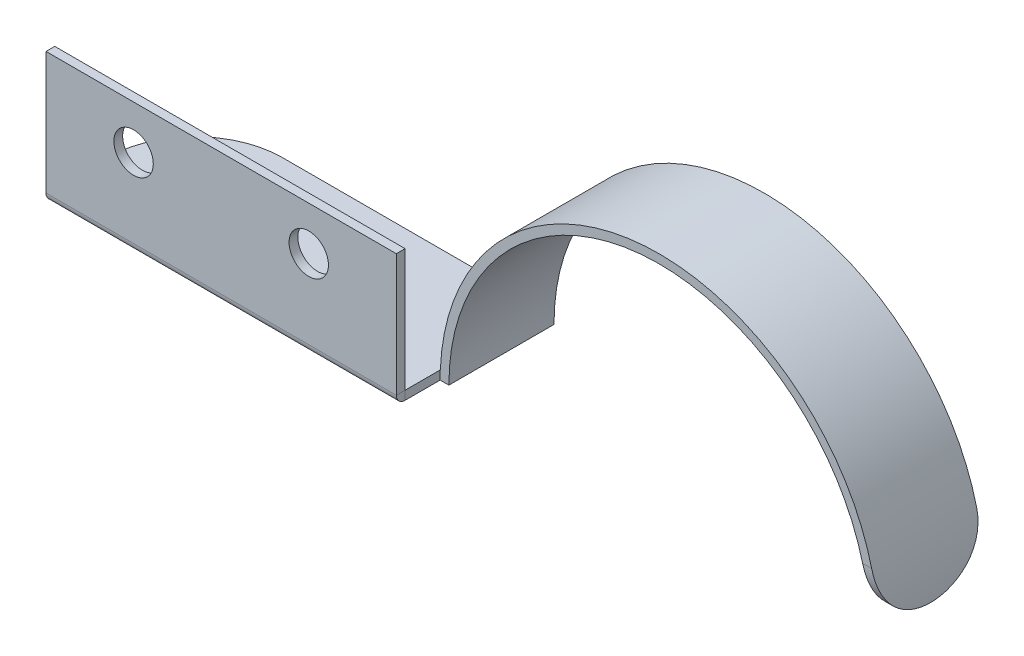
SolidWorks part; units mm, degrees
ref_plane "Front Plane" through (0, 0, 0) normal (0, 0, 1) x (1, 0, 0)
ref_plane "Top Plane" through (0, 0, 0) normal (0, 1, 0) x (1, 0, 0)
ref_plane "Right Plane" through (0, 0, 0) normal (1, 0, 0) x (0, 0, -1)
sketch "Sketch1" plane through (0, 0, 0) normal (0, 1, 0) x (1, 0, 0)
  line L1 (0, 0) -> (40, 0)
  line L2 (0, 0) -> (0, 20)
  line L3 (10, 30) -> (40, 30)
  line L4 (40, 0) -> (40, 30)
  arc A0 (0, 20) -> (10, 30) centre (10, 20) cw
  circle A1 centre (10, 5) radius 2.25
  circle A2 centre (30, 5) radius 2.25
  point P7 (0, 30)
  dimension "D3" = 10
  dimension "D4" = 4.5
  dimension "D5" = 4.5
  dimension "D6" = 5
  dimension "D7" = 5
  dimension "D8" = 10
  dimension "D9" = 10
  dimension "D1" = 40
  dimension "D2" = 30
sheet metal parameters "Sheet-Metal1" thickness 1 parameters "D1"=0.0001
base flange "Base-Flange1" sketch "Sketch1" thickness 1 reverse thickness direction yes parameters "D1"=0.0001
sketch "Sketch3" plane through (0, 1, 0) normal (0, 1, 0) x (1, 0, 0)
  line L0 (0, 14) -> (40, 14)
  line L1 (0, 20) -> (0, 0) construction
  line L2 (40, 0) -> (40, 30) construction
  line L3 (0, 0) -> (40, 0) construction
  dimension "D1" = 14
sketched bend "Sketched Bend1" parameters "D1"=0.001
bend "SketchBend1" bend radius 0.0001 bend angle 90 parameters "D5"=1
sketch "Sketch4" plane through (0, 0, -30) normal (0, 0, -1) x (-1, 0, 0)
  line L0 (-40, 0) -> (-41, 0)
  line L1 (-41, 0) -> (-89, 0) construction
  line L2 (-89, 0) -> (-90, 0)
  line L3 (-40, 1) -> (-40.02, 1)
  line L4 (-40, 1) -> (-40, -0.016)
  arc A0 (-41, 0) -> (-89, 0) centre (-65, 0) ccw
  arc A1 (-40.02, 1) -> (-90, 0) centre (-65, 0) ccw
  dimension "D1" = 1
  dimension "D2" = 24
extrude "Extrude1" add sketch "Sketch4" against normal blind 12 contours L3 A1 L2 A0 L0 M4
ref_plane "Plane1" through (90, 0, 0) normal (1, 0, 0) x (0, 0, -1)
sketch "Sketch5" plane through (90, 0, 0) normal (1, 0, 0) x (0, 0, -1)
  line L0 (24, 0) -> (24, 6) construction
  line L1 (18, 0) -> (30, 0) construction
  line L2 (30, 6) -> (30, 0)
  line L3 (30, 0) -> (24, 0)
  line L4 (18, 6) -> (18, 0)
  line L5 (18, 0) -> (24, 0)
  arc A0 (18, 6) -> (30, 6) centre (24, 6) ccw
  dimension "D2" = 12
  dimension "D1" = 6
extrude "Extrude2" cut sketch "Sketch5" against normal blind 10 contours A0 L4 L5 | A0 L3 L2
flat pattern "Flat-Pattern1"
sketch "Bend-Lines1" plane through (0, 0, 0) normal (0, 1, 0) x (-1, 0, 0)
bend of the flat pattern "Flatten-<SketchBend1>1"
